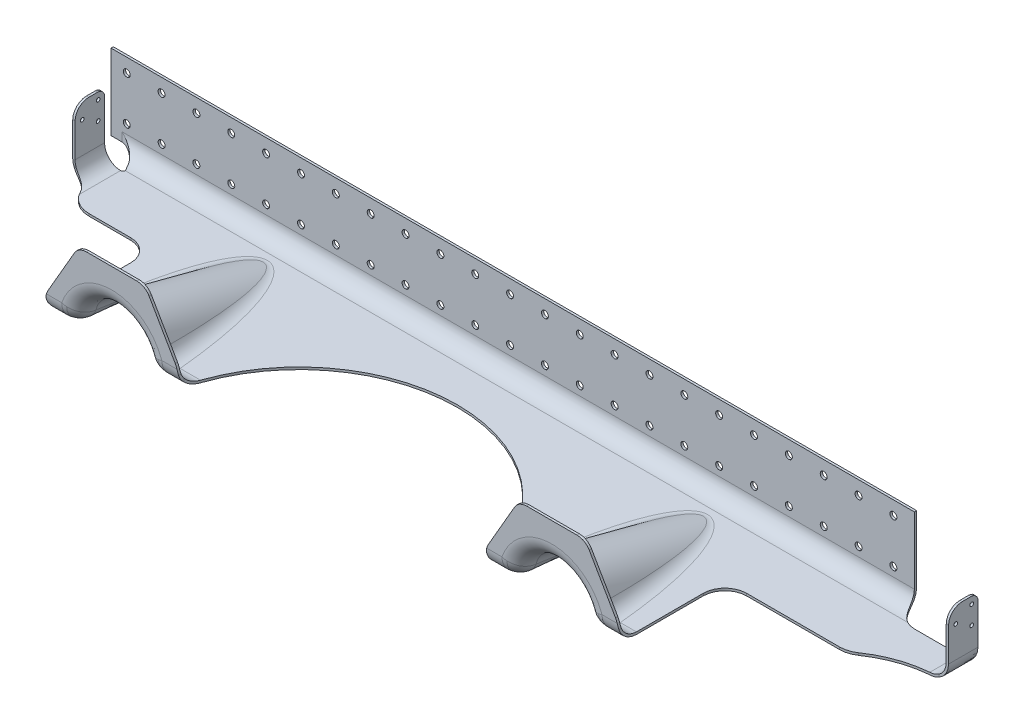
SolidWorks part; units mm, degrees
ref_plane "Front Plane" through (0, 0, 0) normal (1, 0, 0) x (0, 1, 0)
ref_plane "Top Plane" through (0, 0, 0) normal (0, 0, 1) x (0, 1, 0)
ref_plane "Right Plane" through (0, 0, 0) normal (0, 1, 0) x (-1, 0, 0)
sketch "sk 5dia hole pat" plane through (0, 0, 0) normal (0, 0, 1) x (0, 1, 0)
  line L4 (-30.48, -48.26) -> (30.48, -48.26) construction
  point P3 (0, -48.26)
  circle B0 centre (30.48, -579.12) radius 4.826
  circle B1 centre (1188.72, 579.12) radius 4.826
  circle B2 centre (78.74, -579.12) radius 4.826
  circle B3 centre (127, -579.12) radius 4.826
  circle B4 centre (175.26, -579.12) radius 4.826
  circle B5 centre (223.52, -579.12) radius 4.826
  circle B6 centre (271.78, -579.12) radius 4.826
  circle B7 centre (320.04, -579.12) radius 4.826
  circle B8 centre (368.3, -579.12) radius 4.826
  circle B9 centre (416.56, -579.12) radius 4.826
  circle B10 centre (464.82, -579.12) radius 4.826
  circle B11 centre (513.08, -579.12) radius 4.826
  circle B12 centre (561.34, -579.12) radius 4.826
  circle B13 centre (609.6, -579.12) radius 4.826
  circle B14 centre (657.86, -579.12) radius 4.826
  circle B15 centre (706.12, -579.12) radius 4.826
  circle B16 centre (754.38, -579.12) radius 4.826
  circle B17 centre (802.64, -579.12) radius 4.826
  circle B18 centre (850.9, -579.12) radius 4.826
  circle B19 centre (899.16, -579.12) radius 4.826
  circle B20 centre (947.42, -579.12) radius 4.826
  circle B21 centre (995.68, -579.12) radius 4.826
  circle B22 centre (1043.94, -579.12) radius 4.826
  circle B23 centre (1092.2, -579.12) radius 4.826
  circle B24 centre (1140.46, -579.12) radius 4.826
  circle B25 centre (1188.72, -579.12) radius 4.826
  circle B26 centre (30.48, -530.86) radius 4.826
  circle B27 centre (30.48, -482.6) radius 4.826
  circle B28 centre (30.48, -434.34) radius 4.826
  circle B29 centre (30.48, -386.08) radius 4.826
  circle B30 centre (30.48, -337.82) radius 4.826
  circle B31 centre (30.48, -289.56) radius 4.826
  circle B32 centre (30.48, -241.3) radius 4.826
  circle B33 centre (30.48, -193.04) radius 4.826
  circle B34 centre (30.48, -144.78) radius 4.826
  circle B35 centre (30.48, -96.52) radius 4.826
  circle B36 centre (30.48, -48.26) radius 4.826
  circle B37 centre (30.48, 0) radius 4.826
  circle B38 centre (30.48, 48.26) radius 4.826
  circle B39 centre (30.48, 96.52) radius 4.826
  circle B40 centre (30.48, 144.78) radius 4.826
  circle B41 centre (30.48, 193.04) radius 4.826
  circle B42 centre (30.48, 241.3) radius 4.826
  circle B43 centre (30.48, 289.56) radius 4.826
  circle B44 centre (30.48, 337.82) radius 4.826
  circle B45 centre (30.48, 386.08) radius 4.826
  circle B46 centre (30.48, 434.34) radius 4.826
  circle B47 centre (30.48, 482.6) radius 4.826
  circle B48 centre (30.48, 530.86) radius 4.826
  circle B49 centre (30.48, 579.12) radius 4.826
  circle B50 centre (1140.46, 579.12) radius 4.826
  circle B51 centre (1092.2, 579.12) radius 4.826
  circle B52 centre (1043.94, 579.12) radius 4.826
  circle B53 centre (995.68, 579.12) radius 4.826
  circle B54 centre (947.42, 579.12) radius 4.826
  circle B55 centre (899.16, 579.12) radius 4.826
  circle B56 centre (850.9, 579.12) radius 4.826
  circle B57 centre (802.64, 579.12) radius 4.826
  circle B58 centre (754.38, 579.12) radius 4.826
  circle B59 centre (706.12, 579.12) radius 4.826
  circle B60 centre (657.86, 579.12) radius 4.826
  circle B61 centre (609.6, 579.12) radius 4.826
  circle B62 centre (561.34, 579.12) radius 4.826
  circle B63 centre (513.08, 579.12) radius 4.826
  circle B64 centre (464.82, 579.12) radius 4.826
  circle B65 centre (416.56, 579.12) radius 4.826
  circle B66 centre (368.3, 579.12) radius 4.826
  circle B67 centre (320.04, 579.12) radius 4.826
  circle B68 centre (271.78, 579.12) radius 4.826
  circle B69 centre (223.52, 579.12) radius 4.826
  circle B70 centre (175.26, 579.12) radius 4.826
  circle B71 centre (127, 579.12) radius 4.826
  circle B72 centre (78.74, 579.12) radius 4.826
  circle B73 centre (1188.72, 530.86) radius 4.826
  circle B74 centre (1188.72, 482.6) radius 4.826
  circle B75 centre (1188.72, 434.34) radius 4.826
  circle B76 centre (1188.72, 386.08) radius 4.826
  circle B77 centre (1188.72, 337.82) radius 4.826
  circle B78 centre (1188.72, 289.56) radius 4.826
  circle B79 centre (1188.72, 241.3) radius 4.826
  circle B80 centre (1188.72, 193.04) radius 4.826
  circle B81 centre (1188.72, 144.78) radius 4.826
  circle B82 centre (1188.72, 96.52) radius 4.826
  circle B83 centre (1188.72, 48.26) radius 4.826
  circle B84 centre (1188.72, 0) radius 4.826
  circle B85 centre (1188.72, -48.26) radius 4.826
  circle B86 centre (1188.72, -96.52) radius 4.826
  circle B87 centre (1188.72, -144.78) radius 4.826
  circle B88 centre (1188.72, -193.04) radius 4.826
  circle B89 centre (1188.72, -241.3) radius 4.826
  circle B90 centre (1188.72, -289.56) radius 4.826
  circle B91 centre (1188.72, -337.82) radius 4.826
  circle B92 centre (1188.72, -386.08) radius 4.826
  circle B93 centre (1188.72, -434.34) radius 4.826
  circle B94 centre (1188.72, -482.6) radius 4.826
  circle B95 centre (1188.72, -530.86) radius 4.826
  line B96 (609.6, -579.12) -> (609.6, -504.12) construction
  line B97 (30.48, 0) -> (105.48, 0) construction
  circle B98 centre (-30.48, 579.12) radius 4.826
  circle B99 centre (-175.26, -579.12) radius 4.826
  circle B100 centre (-30.48, -579.12) radius 4.826
  circle B101 centre (-78.74, 579.12) radius 4.826
  circle B102 centre (-127, 579.12) radius 4.826
  circle B103 centre (-175.26, 579.12) radius 4.826
  circle B104 centre (-464.82, 579.12) radius 4.826
  circle B105 centre (-706.12, 579.12) radius 4.826
  circle B106 centre (-754.38, 579.12) radius 4.826
  circle B107 centre (-802.64, 579.12) radius 4.826
  circle B108 centre (-899.16, 579.12) radius 4.826
  circle B109 centre (-30.48, 530.86) radius 4.826
  circle B110 centre (-30.48, 482.6) radius 4.826
  circle B111 centre (-30.48, 434.34) radius 4.826
  circle B112 centre (-30.48, 386.08) radius 4.826
  circle B113 centre (-30.48, 337.82) radius 4.826
  circle B114 centre (-30.48, 289.56) radius 4.826
  circle B115 centre (-30.48, 241.3) radius 4.826
  circle B116 centre (-30.48, 193.04) radius 4.826
  circle B117 centre (-30.48, 144.78) radius 4.826
  circle B118 centre (-30.48, 96.52) radius 4.826
  circle B119 centre (-30.48, 48.26) radius 4.826
  circle B120 centre (-30.48, 0) radius 4.826
  circle B121 centre (-30.48, -48.26) radius 4.826
  circle B122 centre (-30.48, -96.52) radius 4.826
  circle B123 centre (-30.48, -144.78) radius 4.826
  circle B124 centre (-30.48, -241.3) radius 4.826
  circle B125 centre (-30.48, -289.56) radius 4.826
  circle B126 centre (-30.48, -337.82) radius 4.826
  circle B127 centre (-30.48, -386.08) radius 4.826
  circle B128 centre (-30.48, -434.34) radius 4.826
  circle B129 centre (-30.48, -482.6) radius 4.826
  circle B130 centre (-30.48, -530.86) radius 4.826
  line B131 (-1188.72, 0) -> (-1113.72, 0) construction
  dimension "D1" = 60.96
sketch_block_instance "5dia hole pat-1"
sketch_block "5dia hole pat" parameters "D1"=9.652, "D2"=9.652, "D3"=75
sketch_block_instance "5dia hole pat-2"
sketch "sk 47.986in pnl" plane through (0, 0, 0) normal (0, 0, 1) x (0, 1, 0)
  line B0 (0.1778, 0) -> (1219.0222, 0) construction
  line B1 (0.1778, 609.4222) -> (1219.0222, 609.4222)
  line B2 (0.1778, 609.4222) -> (0.1778, -609.4222)
  line B3 (0.1778, -609.4222) -> (1219.0222, -609.4222)
  line B4 (1219.0222, 609.4222) -> (1219.0222, -609.4222)
  line B5 (609.6, 609.4222) -> (609.6, -609.4222) construction
  line B6 (-1219.0222, 0) -> (-0.1778, 0) construction
  line B7 (-1219.0222, 609.4222) -> (-0.1778, 609.4222)
  line B8 (-1219.0222, 609.4222) -> (-1219.0222, -609.4222)
  line B9 (-1219.0222, -609.4222) -> (-0.1778, -609.4222)
  line B10 (-0.1778, 609.4222) -> (-0.1778, -609.4222)
  line B11 (-609.6, 609.4222) -> (-609.6, -609.4222) construction
  dimension "D1" = 30.3022
  dimension "D2" = 30.3022
sketch_block_instance "47.986in pnl-1"
sketch_block "47.986in pnl" parameters "D1"=1218.8444, "D2"=1218.8444
sketch_block_instance "47.986in pnl-2"
sketch "sk Main Body" plane through (0, 0, 0) normal (1, 0, 0) x (0, 1, 0)
  line L0 (49.53, 0) -> (-43.18, 0)
  line L1 (-68.58, 25.4) -> (-68.58, 107.95)
  line L2 (49.53, 3.175) -> (-43.18, 3.175)
  line L3 (-65.405, 25.4) -> (-65.405, 107.95)
  line L4 (-68.58, 107.95) -> (-65.405, 107.95)
  line L5 (49.53, 0) -> (49.53, 3.175)
  line L6 (670.3644, 0) -> (-670.3644, 0) construction
  arc A0 (-43.18, 0) -> (-68.58, 25.4) centre (-43.18, 25.4) cw
  arc A1 (-43.18, 3.175) -> (-65.405, 25.4) centre (-43.18, 25.4) cw
  dimension "D2" = 25.4
  dimension "D1" = 19.05
  dimension "D3" = 12.7
  dimension "D5" = 82.55
  dimension "D4" = 3.175
extrude "Main Body" add sketch "sk Main Body" along normal mid plane 1218.8444
sketch "sk Vert Rib Body" plane through (0, 0, 0) normal (0, 1, 0) x (-1, 0, 0)
  line L3 (55, 0) -> (-55, 0) construction
  line L10 (-609.4222, 3.175) -> (609.4222, 3.175) construction
  point P3 (-560.07, 1.5875)
  point P7 (554.1233, 3.175)
  point P11 (554.1233, 3.175)
  line B0 (-560.07, 0) -> (-652.78, 0)
  line B1 (-678.18, 25.4) -> (-678.18, 158.75)
  line B2 (-652.78, 184.15) -> (-617.22, 184.15)
  line B3 (-636.27, 213.8401) -> (-636.27, 147.2198) construction
  line B4 (-560.07, 3.175) -> (-652.78, 3.175)
  line B5 (-675.005, 25.4) -> (-675.005, 158.75)
  line B6 (-652.78, 180.975) -> (-617.22, 180.975)
  line B7 (-617.22, 184.15) -> (-617.22, 180.975)
  line B8 (-560.07, 3.175) -> (-560.07, 0)
  arc B9 (-652.78, 0) -> (-678.18, 25.4) centre (-652.78, 25.4) cw
  arc B10 (-678.18, 158.75) -> (-652.78, 184.15) centre (-652.78, 158.75) cw
  arc B11 (-652.78, 3.175) -> (-675.005, 25.4) centre (-652.78, 25.4) cw
  arc B12 (-675.005, 158.75) -> (-652.78, 180.975) centre (-652.78, 158.75) cw
  line B13 (659.13, 0) -> (566.42, 0)
  line B14 (541.02, 25.4) -> (541.02, 158.75)
  line B15 (659.13, 3.175) -> (566.42, 3.175)
  line B16 (544.195, 25.4) -> (544.195, 158.75)
  line B17 (659.13, 3.175) -> (659.13, 0)
  arc B18 (566.42, 0) -> (541.02, 25.4) centre (566.42, 25.4) cw
  arc B19 (541.02, 158.75) -> (566.42, 184.15) centre (566.42, 158.75) cw
  arc B20 (566.42, 3.175) -> (544.195, 25.4) centre (566.42, 25.4) cw
  dimension "D2" = 19.05
  dimension "D1" = 12.7
sketch_block_instance "Vert Rib Body-1"
sketch_block "Vert Rib Body" parameters "D1"=25.4, "D2"=16.51, "D3"=19.05, "D4"=177.8
sketch_block_instance "Vert Rib Body-2"
sketch "Interferance" plane through (0, 0, 0) normal (0, 0, 1) x (0, 1, 0)
  line L0 (0.1778, 609.4222) -> (1219.0222, 609.4222) construction
  line L1 (-68.58, 541.02) -> (-46.1715, 541.02)
  line L2 (-68.58, 541.02) -> (-68.58, 609.4222)
  line L3 (-68.58, 609.4222) -> (-46.1715, 609.4222)
  line L4 (-46.1715, 541.02) -> (-46.1715, 609.4222)
  line L8 (-68.58, -609.4222) -> (-68.58, 609.4222) construction
  line L9 (0.1778, -609.4222) -> (1219.0222, -609.4222) construction
  line L10 (-68.58, -609.4222) -> (49.53, -609.4222)
  line L11 (-68.58, -609.4222) -> (-68.58, -560.07)
  line L12 (-68.58, -560.07) -> (49.53, -560.07)
  line L13 (49.53, -609.4222) -> (49.53, -560.07)
  line L14 (49.53, -609.4222) -> (49.53, 609.4222) construction
  line L20 (-46.1715, 554.1233) -> (68.9891, 554.1233)
  dimension "D1" = 68.4022
  dimension "D2" = 49.3522
  dimension "D3" = 55.2989
sketch "sk lateral cut" plane through (0, 0, 0) normal (0, 1, 0) x (-1, 0, 0)
  line L0 (541.02, 25.4) -> (541.02, 158.75) construction
  line L1 (620.2848, 124.072) -> (540.766, 124.072)
  line L2 (620.2848, 124.072) -> (620.2848, 3.175)
  line L3 (620.2848, 3.175) -> (514.0325, 3.175)
  line L4 (540.766, 124.072) -> (540.766, 43.7253) construction
  line L5 (514.0325, 124.072) -> (514.0325, 3.175)
  line L6 (-609.4222, 3.175) -> (609.4222, 3.175) construction
  line L7 (514.0325, 124.072) -> (540.766, 124.072)
  dimension "D1" = 0.254
  dimension "D3" = 26.7335
extrude " Lateral cut" cut sketch "sk lateral cut" against normal through all
sketch "Sketch4" plane through (0, 0, 0) normal (0, 0, 1) x (0, 1, 0)
  line L0 (-68.58, -560.07) -> (49.53, -560.07) construction
  line L1 (-94.7483, -559.816) -> (63.9754, -559.816)
  line L2 (-94.7483, -559.816) -> (-94.7483, -630.9346)
  line L3 (-94.7483, -630.9346) -> (63.9754, -630.9346)
  line L4 (63.9754, -559.816) -> (63.9754, -630.9346)
  line L10 (-77.8228, 552.5358) -> (63.9754, 552.5358)
  line L11 (-46.1715, 554.1233) -> (68.9891, 554.1233) construction
  line L12 (-77.8228, 552.5358) -> (-77.8228, 644.2383)
  line L13 (-77.8228, 644.2383) -> (63.9754, 644.2383)
  line L14 (63.9754, 644.2383) -> (63.9754, 552.5358)
  dimension "D1" = 0.254
  dimension "D2" = 1.5875
extrude "Up Dwn cut" cut sketch "Sketch4" along normal through all
ref_plane "Tab lower pln" through (0, 0, 25.4) normal (0, 0, 1) x (0, 1, 0)
ref_plane "Left tab pln" through (673.4175, 0, 0) normal (1, 0, 0) x (0, 1, 0)
ref_plane "Right tab pln" through (-539.4325, 0, 0) normal (1, 0, 0) x (0, 1, 0)
sketch "Sketch5" plane through (0, 0, 25.4) normal (0, 0, 1) x (0, 1, 0)
  line L0 (-68.58, -557.816) -> (-68.58, -648.0175)
  line L1 (-43.18, -673.4175) -> (22.3, -673.4175)
  line L2 (-65.405, -557.816) -> (-65.405, -648.0175)
  line L3 (-43.18, -670.2425) -> (22.3, -670.2425)
  line L4 (-68.58, -557.816) -> (-65.405, -557.816)
  line L5 (22.3, -673.4175) -> (22.3, -670.2425)
  line L6 (-68.58, -559.816) -> (-68.58, 514.0325) construction
  line L7 (-65.405, -559.816) -> (-68.58, -559.816) construction
  line L8 (-64.9605, -673.4175) -> (64.9605, -673.4175) construction
  line L9 (22.3, 539.4325) -> (-43.18, 539.4325)
  line L10 (-68.58, 514.0325) -> (-68.58, 509.0325)
  line L11 (22.3, 536.2575) -> (-43.18, 536.2575)
  line L12 (-65.405, 514.0325) -> (-65.405, 509.0325)
  line L13 (22.3, 539.4325) -> (22.3, 536.2575)
  line L14 (-65.405, 509.0325) -> (-68.58, 509.0325)
  line L15 (-64.9605, 539.4325) -> (64.9605, 539.4325) construction
  arc A0 (-68.58, -648.0175) -> (-43.18, -673.4175) centre (-43.18, -648.0175) ccw
  arc A1 (-65.405, -648.0175) -> (-43.18, -670.2425) centre (-43.18, -648.0175) ccw
  arc A2 (-43.18, 539.4325) -> (-68.58, 514.0325) centre (-43.18, 514.0325) ccw
  arc A3 (-43.18, 536.2575) -> (-65.405, 514.0325) centre (-43.18, 514.0325) ccw
  dimension "D1" = 25.4
  dimension "D5" = 25.4
  dimension "D3" = 2
  dimension "D4" = 87.705
  dimension "D7" = 87.705
  dimension "D8" = 5
  dimension "D2" = 3.175
  dimension "D6" = 3.175
extrude "Tab Main bdy" add sketch "Sketch5" along normal blind 44
sketch "Sketch8" plane through (0, 0, 0) normal (0, 1, 0) x (-1, 0, 0)
  line L0 (514.0325, 25.4) -> (572.9376, 25.4) construction
  line L1 (514.0325, 28.575) -> (572.9376, 28.575)
  line L2 (514.0325, 22.225) -> (572.9376, 22.225)
  line L3 (-559.816, 25.4) -> (514.0325, 25.4) construction
  line L4 (514.0325, 25.4) -> (514.0325, 69.4) construction
  line L5 (-559.816, 25.4) -> (-559.816, 3.175) construction
  line L6 (-696.7859, 28.575) -> (-559.816, 28.575)
  line L7 (-696.7859, 28.575) -> (-696.7859, 5.0296)
  line L8 (-696.7859, 5.0296) -> (-559.816, 5.0296)
  line L9 (-559.816, 28.575) -> (-559.816, 5.0296)
  arc A0 (514.0325, 28.575) -> (514.0325, 22.225) centre (514.0325, 25.4) ccw
  arc A1 (572.9376, 22.225) -> (572.9376, 28.575) centre (572.9376, 25.4) ccw
  point P2 (543.485, 25.4)
  dimension "D1" = 3.175
extrude "Tab undercut" cut sketch "Sketch8" against normal through all both and the other way through all
fillet "Fillet2" radius 12.2 1 edges at (-514.0325, -66.7789, 22.225)
fillet "Fillet3" radius 25.4 1 edges at (-514.0325, -49.3284, 3.175)
fillet "Fillet4" radius 150 1 edges at (559.816, -66.9925, 69.4)
fillet "Fillet5" radius 22 1 edges at (-514.0325, -66.9925, 69.4)
fillet "Fillet6" radius 25.4 3 edges at (559.816, -66.9925, 107.95) (-514.0325, -66.9925, 107.95) (559.816, -66.9925, 28.575)
fillet "Fillet7" radius 19.05 2 edges at (-537.845, 22.3, 69.4) (671.83, 22.3, 69.4)
fillet "Fillet8" radius 9.525 2 edges at (671.83, 22.3, 28.575) (-537.845, 22.3, 28.575)
sketch "Sketch6" plane through (0, 0, 0) normal (1, 0, 0) x (0, 1, 0)
  line L0 (64.9605, 25.4) -> (-64.9605, 25.4) construction
  line L1 (0, -59.3725) -> (0, 59.3725) construction
  circle A0 centre (0, 59.397) radius 10 construction
  circle A1 centre (12.7, 37.4) radius 10 construction
  circle A2 centre (-12.7, 37.4) radius 10 construction
  line B0 (12.7, 37.4) -> (-12.7, 37.4) construction
  circle B1 centre (-12.7, 37.4) radius 2.5908
  circle B2 centre (12.7, 37.4) radius 2.5908
  circle B3 centre (0, 59.397) radius 2.5908
  line B4 (0, 37.4) -> (0, 44.7323) construction
  dimension "D2" = 20
  dimension "D3" = 20
  dimension "D4" = 20
  dimension "D1" = 12
sketch_block_instance "Blind Rivet holes-1"
sketch_block "Blind Rivet holes" parameters "D1"=5.1816, "D2"=5.1816, "D3"=5.1816, "D4"=60, "D5"=60, "D6"=25.4, "D7"=25.4, "D8"=25.4
sketch "Sketch9" plane through (0, 0, 0) normal (0, 0, 1) x (0, 1, 0)
  circle A0 centre (-30.48, -530.86) radius 4.826
  circle A1 centre (30.48, -530.86) radius 4.826
  circle A2 centre (-30.48, -530.86) radius 4.826 construction
  circle A3 centre (30.48, -530.86) radius 4.826 construction
  circle A4 centre (-30.48, -482.6) radius 4.826
  circle A5 centre (30.48, -482.6) radius 4.826
  circle A6 centre (-30.48, -434.34) radius 4.826
  circle A7 centre (30.48, -434.34) radius 4.826
  circle A8 centre (-30.48, -386.08) radius 4.826
  circle A9 centre (30.48, -386.08) radius 4.826
  circle A10 centre (-30.48, -337.82) radius 4.826
  circle A11 centre (30.48, -337.82) radius 4.826
  circle A12 centre (-30.48, -289.56) radius 4.826
  circle A13 centre (30.48, -289.56) radius 4.826
  circle A14 centre (-30.48, -241.3) radius 4.826
  circle A15 centre (30.48, -241.3) radius 4.826
  circle A16 centre (-30.48, -193.04) radius 4.826
  circle A17 centre (30.48, -193.04) radius 4.826
  circle A18 centre (-30.48, -144.78) radius 4.826
  circle A19 centre (30.48, -144.78) radius 4.826
  circle A20 centre (-30.48, -96.52) radius 4.826
  circle A21 centre (30.48, -96.52) radius 4.826
  circle A22 centre (-30.48, -48.26) radius 4.826
  circle A23 centre (30.48, -48.26) radius 4.826
  circle A24 centre (-30.48, 0) radius 4.826
  circle A25 centre (30.48, 0) radius 4.826
  circle A26 centre (-30.48, 48.26) radius 4.826
  circle A27 centre (30.48, 48.26) radius 4.826
  circle A28 centre (-30.48, 96.52) radius 4.826
  circle A29 centre (30.48, 96.52) radius 4.826
  circle A30 centre (-30.48, 144.78) radius 4.826
  circle A31 centre (30.48, 144.78) radius 4.826
  circle A32 centre (-30.48, 193.04) radius 4.826
  circle A33 centre (30.48, 193.04) radius 4.826
  circle A34 centre (-30.48, 241.3) radius 4.826
  circle A35 centre (30.48, 241.3) radius 4.826
  circle A36 centre (-30.48, 289.56) radius 4.826
  circle A37 centre (30.48, 289.56) radius 4.826
  circle A38 centre (-30.48, 337.82) radius 4.826
  circle A39 centre (30.48, 337.82) radius 4.826
  circle A40 centre (-30.48, 386.08) radius 4.826
  circle A41 centre (30.48, 386.08) radius 4.826
  circle A42 centre (-30.48, 434.34) radius 4.826
  circle A43 centre (30.48, 434.34) radius 4.826
  circle A44 centre (-30.48, 482.6) radius 4.826
  circle A45 centre (30.48, 482.6) radius 4.826
  circle A46 centre (-30.48, 530.86) radius 4.826
  circle A47 centre (30.48, 530.86) radius 4.826
  dimension "D1" = 23
extrude "Base holes" cut sketch "Sketch9" along normal blind 10
extrude "cut Rivet" cut sketch "Sketch6" against normal through all both and the other way through all
sketch "Sketch10" [suppressed] plane through (0, 0, 0) normal (0, 0, 1) x (0, 1, 0)
  line L0 (-0.1778, 609.4222) -> (-0.1778, -609.4222) construction
  line L1 (-0.1778, 554.9718) -> (184.2643, 554.9718)
  line L2 (-0.1778, 554.9718) -> (-0.1778, -580.5661)
  line L3 (-0.1778, -580.5661) -> (184.2643, -580.5661)
  line L4 (184.2643, 554.9718) -> (184.2643, -580.5661)
extrude "Cut-Extrude1" [suppressed] cut sketch "Sketch10" along normal blind 10
sketch "Sketch11" plane through (0, 0, 0) normal (1, 0, 0) x (0, 1, 0)
  line L0 (49.53, 0) -> (-43.18, 0) construction
  line L1 (-68.58, 25.4) -> (-68.58, 224.6)
  line L2 (-43.18, 250) -> (34.925, 250)
  line L3 (-26.67, 286.5873) -> (-26.67, 219.967) construction
  line L4 (49.53, 3.175) -> (-43.18, 3.175) construction
  line L5 (-65.405, 25.4) -> (-65.405, 224.6)
  line L6 (-43.18, 246.825) -> (34.925, 246.825)
  line L7 (34.925, 250) -> (34.925, 246.825)
  line L8 (49.53, 3.175) -> (49.53, 0) construction
  line L10 (49.53, 0) -> (-43.18, 0) construction
  line L11 (49.53, 0) -> (49.53, 3.175) construction
  line L12 (-68.58, 25.4) -> (-65.405, 25.4)
  arc A0 (-43.18, 0) -> (-68.58, 25.4) centre (-43.18, 25.4) cw construction
  arc A1 (-68.58, 224.6) -> (-43.18, 250) centre (-43.18, 224.6) cw
  arc A2 (-43.18, 3.175) -> (-65.405, 25.4) centre (-43.18, 25.4) cw construction
  arc A3 (-65.405, 224.6) -> (-43.18, 246.825) centre (-43.18, 224.6) cw
  dimension "D2" = 25.4
  dimension "D4" = 16.51
  dimension "D5" = 61.595
  dimension "D7" = 243.65
  dimension "D6" = 3.175
extrude "Boss-Extrude1" add sketch "Sketch11" along normal mid plane 1010
sketch "Sketch12" plane through (0, 0, 250) normal (0, 0, 1) x (1, 0, 0)
  line L0 (-396.0595, -43.18) -> (-304.8, 114.8861)
  line L2 (-304.8, 114.8861) -> (-213.5405, -43.18)
  line L3 (-396.0595, -43.18) -> (-638.8127, -43.18)
  line L4 (-638.8127, -43.18) -> (-638.8127, 115.8831)
  line L6 (213.5405, -43.18) -> (304.8, 114.8861)
  line L7 (304.8, 114.8861) -> (396.0595, -43.18)
  line L8 (396.0595, -43.18) -> (645.1619, -43.18)
  line L9 (645.1619, -43.18) -> (645.1619, 115.8831)
  line L10 (-213.5405, -43.18) -> (213.5405, -43.18)
  line L11 (-638.8127, 115.8831) -> (645.1619, 115.8831)
  line L12 (505, -43.18) -> (-505, -43.18) construction
  point P2 (0, -43.18)
  dimension "D1" = 120
  dimension "D2" = 120
  dimension "D3" = 60
  dimension "D4" = 60
  dimension "D5" = 182.5191
  dimension "D6" = 182.5191
  dimension "D7" = 427.0809
extrude "Cut-Extrude2" cut sketch "Sketch12" against normal blind 10
sketch "Sketch13" plane through (0, 0, 0) normal (0, 1, 0) x (-1, 0, 0)
  line L0 (-213.5405, 246.825) -> (-213.5405, 277.059)
  line L4 (-213.5405, 277.059) -> (213.5405, 277.059)
  line L5 (213.5405, 277.059) -> (213.5405, 246.825)
  line L7 (-572.9193, 25.4) -> (510.8575, 25.4) construction
  line L8 (-213.5405, 246.825) -> (-213.5405, 250) construction
  line L9 (213.5405, 246.825) -> (213.5405, 250) construction
  arc A2 (-213.5405, 246.825) -> (213.5405, 246.825) centre (0, 295.1375) ccw
  point P2 (0, 76.2)
  dimension "D1" = 50.8
extrude "Cut-Extrude3" cut sketch "Sketch13" against normal through all
sketch "Sketch14" plane through (0, 0, 0) normal (0, 1, 0) x (-1, 0, 0)
  line L6 (396.0595, 246.825) -> (396.0595, 288.5559)
  line L7 (396.0595, 288.5559) -> (646.1786, 288.5559)
  line L8 (646.1786, 288.5559) -> (646.1786, 69.397)
  line L9 (646.1786, 69.397) -> (609.6, 69.397)
  line L10 (-396.0595, 246.825) -> (-396.0595, 291.6094)
  line L11 (-396.0595, 291.6094) -> (-686.7988, 291.6094)
  line L12 (-686.7988, 291.6094) -> (-686.7988, 69.397)
  line L13 (-686.7988, 69.397) -> (-609.6, 69.397)
  arc A2 (396.0595, 246.825) -> (609.6, 69.397) centre (609.6, 286.6126) ccw
  arc A3 (-396.0595, 246.825) -> (-609.6, 69.397) centre (-609.6, 286.6126) cw
fillet "Fillet9" radius 19.05 4 edges at (-350.9656, 34.925, 248.4125) (-258.6344, 34.925, 248.4125) (258.6344, 34.925, 248.4125) (350.9656, 34.925, 248.4125)
sketch "Collar Interferance" plane through (0, 0, 0) normal (0, 1, 0) x (-1, 0, 0)
  line B0 (406.4, 281.3006) -> (718.4077, 281.3006)
  line B1 (406.4, 281.3006) -> (406.4, 112)
  line B2 (406.4, 112) -> (718.4077, 112)
  line B3 (718.4077, 281.3006) -> (718.4077, 112)
  line B4 (-700.5611, 281.3006) -> (-406.4, 281.3006)
  line B5 (-700.5611, 281.3006) -> (-700.5611, 112)
  line B6 (-700.5611, 112) -> (-406.4, 112)
  line B7 (-406.4, 281.3006) -> (-406.4, 112)
  dimension "D1" = 406.4
  dimension "D2" = 112
sketch_block_instance "Block1-1"
sketch_block "Block1"
sketch "Sketch16" plane through (0, 0, 0) normal (0, 1, 0) x (-1, 0, 0)
  line L0 (-700.5611, 112) -> (-406.4, 112) construction
  line L1 (-406.4, 281.3006) -> (-406.4, 112) construction
  line L2 (406.4, 112) -> (718.4077, 112) construction
  line L3 (406.4, 281.3006) -> (406.4, 112) construction
  line L18 (-396.4, 291.3006) -> (-710.5611, 291.3006)
  line L19 (-396.4, 132) -> (-396.4, 291.3006)
  line L20 (-710.5611, 102) -> (-426.4, 102)
  line L21 (-710.5611, 291.3006) -> (-710.5611, 102)
  line L30 (728.4077, 291.3006) -> (396.4, 291.3006)
  line L31 (728.4077, 102) -> (728.4077, 291.3006)
  line L32 (426.4, 102) -> (728.4077, 102)
  line L33 (396.4, 291.3006) -> (396.4, 132)
  arc A0 (426.4, 102) -> (396.4, 132) centre (426.4, 132) cw
  arc A1 (-396.4, 132) -> (-426.4, 102) centre (-426.4, 132) cw
  dimension "D3" = 30
  dimension "D1" = 10
  dimension "D2" = 10
  dimension "D4" = 10
  dimension "D5" = 10
extrude "Cut-Extrude4" cut sketch "Sketch16" against normal through all
fillet "Fillet10" radius 35 5 edges at (-505.8018, -66.9925, 102) (566.8436, -66.9925, 102) (213.5405, -49.3284, 246.825) (-396.4, -43.18, 248.4125) (-213.5405, -49.3284, 246.825)
fillet "Fillet11" radius 25.4 4 edges at (396.4, -43.18, 248.4125) (213.4511, -43.3348, 248.408) (-396.0595, -43.18, 248.4125) (-213.4511, -43.3348, 248.408)
fillet "Fillet12" radius 25.4 1 edges at (396.0595, -43.18, 248.4125)
sketch "Sketch18" plane through (0, 0, 250) normal (0, 0, 1) x (1, 0, 0)
  line L0 (-304.8, -9.525) -> (304.8, -9.525)
  line L1 (-269.6329, 34.925) -> (-339.9671, 34.925) construction
  line L2 (339.9671, 34.925) -> (269.6329, 34.925) construction
  point P2 (-304.8, 34.925)
  point P3 (304.8, 34.925)
  point P10 (0, -9.525)
  dimension "D1" = 44.45
sketch "Sketch17" plane through (0, 0, 0) normal (1, 0, 0) x (0, 1, 0)
  line L0 (-68.58, 25.4) -> (-9.525, 250)
  line L1 (-9.525, 250) -> (-42.4188, 258.6489)
  point P5 (-42.4188, 258.6489)
ref_plane "Plane1" through (0, 60.867, 231.4915) normal (0, 0.2543, 0.9671) x (0, -0.9671, 0.2543)
sketch "Sketch19" plane through (0, 60.867, 231.4915) normal (0, 0.2543, 0.9671) x (0, -0.9671, 0.2543)
  line L3 (72.7846, -304.8) -> (72.7846, 304.8) construction
  line L4 (124.2743, 209.3503) -> (124.2743, 396.4) construction
  line L5 (124.2743, -396.4) -> (124.2743, -209.3504) construction
  circle A0 centre (124.2743, 304.8) radius 51.4897
  circle A1 centre (124.2743, -304.8) radius 51.4897
extrude "Cut-Extrude5" cut sketch "Sketch19" against normal through all
sketch "Sketch20" plane through (0, 60.867, 231.4915) normal (0, 0.2543, 0.9671) x (0, -0.9671, 0.2543)
  line L0 (124.2743, -253.3103) -> (124.2743, -256.4853)
  line L1 (124.2743, 256.4853) -> (124.2743, 253.3103)
  line L2 (124.2743, 356.2897) -> (124.2743, 353.1147)
  line L4 (124.2743, -353.1147) -> (124.2743, -356.2897)
  line L5 (124.2743, 356.2897) -> (124.2743, 396.4) construction
  line L6 (124.2743, -253.3103) -> (124.2743, -209.3504) construction
  line L7 (124.2743, -396.4) -> (124.2743, -356.2897) construction
  line L8 (124.2743, 209.3503) -> (124.2743, 253.3103) construction
  arc A0 (124.2743, 356.2897) -> (124.2743, 253.3103) centre (124.2743, 304.8) ccw
  arc A1 (124.2743, -253.3103) -> (124.2743, -356.2897) centre (124.2743, -304.8) ccw
  arc A4 (124.2743, 353.1147) -> (124.2743, 256.4853) centre (124.2743, 304.8) ccw
  arc A5 (124.2743, -256.4853) -> (124.2743, -353.1147) centre (124.2743, -304.8) ccw
  arc A6 (109.1298, 354.0121) -> (105.2324, 256.9607) centre (124.2743, 304.8) ccw construction
  arc A7 (110.0636, 350.9776) -> (106.4066, 259.9106) centre (124.2743, 304.8) ccw construction
  circle A8 centre (124.2743, 304.8) radius 51.4897 construction
  circle A9 centre (124.2743, -304.8) radius 51.4897 construction
  dimension "D1" = 3.175
extrude "Boss-Extrude2" add sketch "Sketch20" against normal through all
sketch "Sketch21" plane through (0, 0, 0) normal (1, 0, 0) x (0, 1, 0)
  line L8 (-68.58, 224.6) -> (-68.58, 25.4) construction
  line L9 (25.4, 250) -> (-37.8756, 250) construction
  line B0 (34.6982, 250) -> (-43.18, 250)
  line B1 (-68.58, 224.6) -> (-68.58, 25.4)
  line B2 (-43.18, 0) -> (-29.8301, 0)
  line B3 (-29.8301, 0) -> (-29.8301, -41.1008)
  line B4 (-29.8301, -41.1008) -> (-144.5548, -41.1008)
  line B5 (-144.5548, -41.1008) -> (-144.5548, 281.4583)
  line B6 (-144.5548, 281.4583) -> (34.6982, 281.4583)
  line B7 (34.6982, 281.4583) -> (34.6982, 250)
  arc B8 (-68.58, 25.4) -> (-43.18, 0) centre (-43.18, 25.4) ccw
  arc B9 (-43.18, 250) -> (-68.58, 224.6) centre (-43.18, 224.6) ccw
sketch_block_instance "Block2-1"
sketch_block "Block2"
extrude "Cut-Extrude6" cut sketch "Sketch21" against normal through all both and the other way through all
fillet "Fillet13" radius 22.352 8 edges at (-355.6427, -56.3164, 242.5272) (-253.5603, -60.5615, 238.4505) (-304.8, -10.3598, 246.825) (253.9573, -56.3164, 242.5272) (356.0397, -60.5615, 238.4505) (304.8, -10.3598, 246.825) (-304.8, -65.405, 37.4753) (304.8, -65.405, 37.4753)
fillet "Fillet14" radius 25.527 8 edges at (-353.0654, -63.0157, 240.4652) (-256.8566, -57.8011, 245.3698) (-304.8, -12.8079, 250) (256.5346, -63.0157, 240.4652) (352.7434, -57.8011, 245.3698) (304.8, -12.8079, 250) (-304.8, -68.58, 37.8857) (304.8, -68.58, 37.8857)
equation "\"3i\"=138.375"
equation "\".75i\"=12.7"
